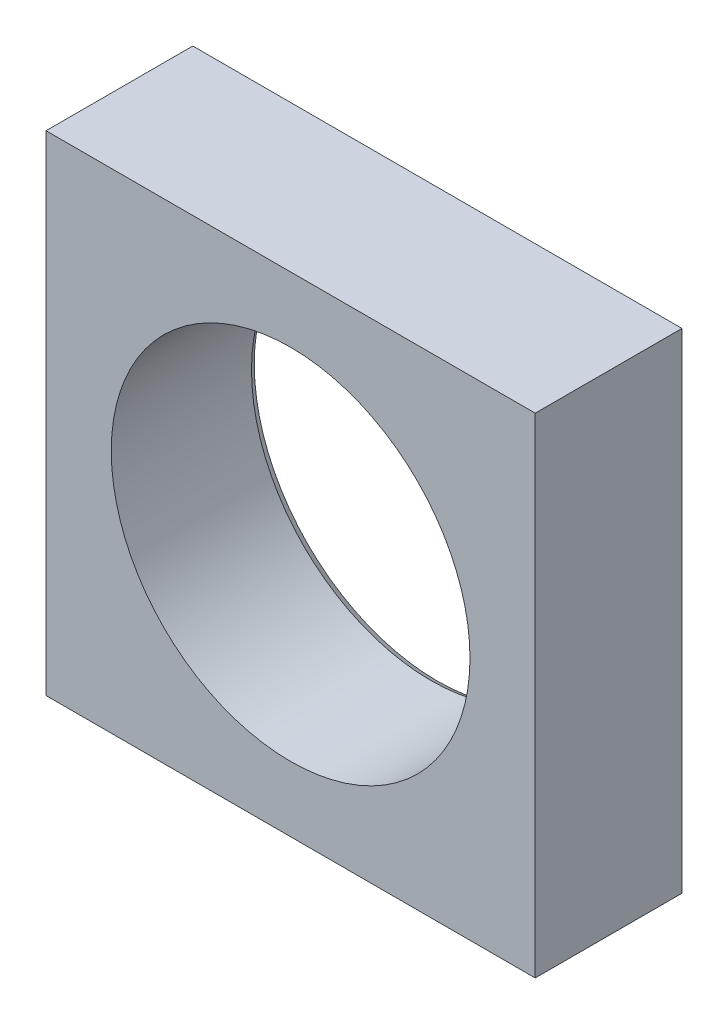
SolidWorks part; units mm, degrees
ref_plane "Face" through (0, 0, 0) normal (0, 0, 1) x (1, 0, 0)
ref_plane "Dessus" through (0, 0, 0) normal (0, 1, 0) x (1, 0, 0)
ref_plane "Droite" through (0, 0, 0) normal (1, 0, 0) x (0, 0, -1)
mirrored part "141C_Rendre symétrique"
other "<141C>-<Chanfrein1>"
